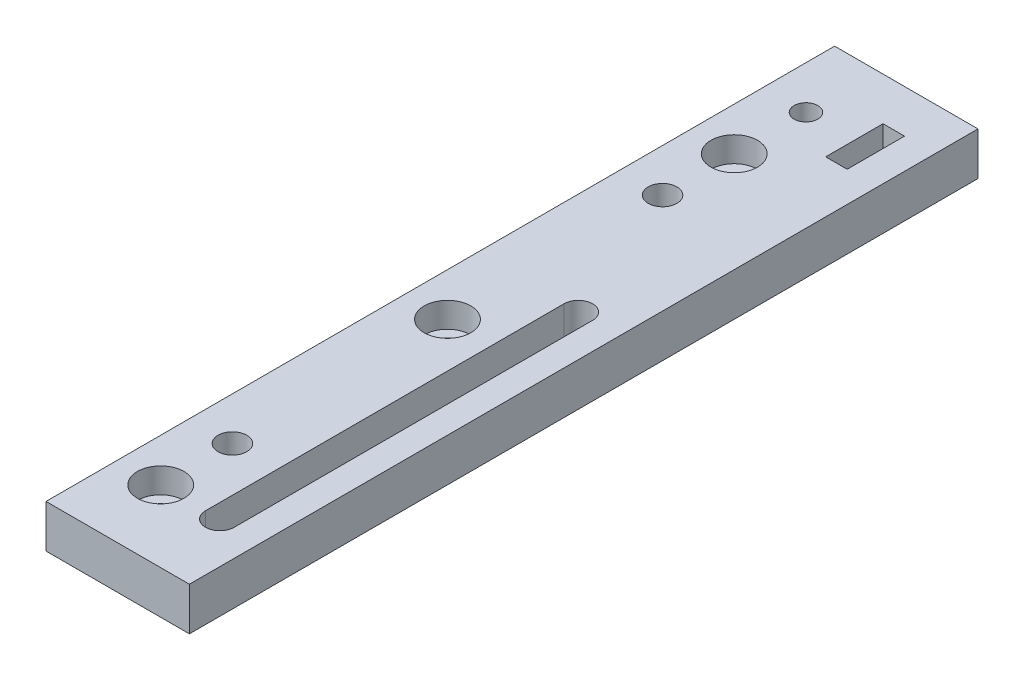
SolidWorks part; units mm, degrees
ref_plane "前视基准面" through (0, 0, 0) normal (0, 0, 1) x (1, 0, 0)
ref_plane "上视基准面" through (0, 0, 0) normal (0, 1, 0) x (1, 0, 0)
ref_plane "右视基准面" through (0, 0, 0) normal (1, 0, 0) x (0, 0, -1)
sketch "草图1" plane through (0, 0, 0) normal (0, 0, 1) x (1, 0, 0)
  line L0 (0, 0) -> (0, 6)
  line L1 (20, 0) -> (20, 6)
  line L2 (0, 0) -> (20, 0)
  line L3 (0, 6) -> (20, 6)
extrude "凸台-拉伸1" add sketch "草图1" along normal blind 110
sketch "草图2" plane through (0, 6, 0) normal (0, 1, 0) x (1, 0, 0)
  line L0 (0, -110) -> (0, 0)
  line L1 (20, -110) -> (20, 0)
  line L2 (0, -110) -> (20, -110)
  line L3 (0, 0) -> (20, 0)
  line L4 (12.25, -50) -> (12.25, -100)
  line L5 (16.25, -100) -> (16.25, -50)
  line L6 (12.75, -14) -> (12.75, -6)
  line L7 (15.75, -14) -> (15.75, -6)
  line L8 (12.75, -6) -> (15.75, -6)
  line L9 (12.75, -14) -> (15.75, -14)
  circle A0 centre (6, -20) radius 1.75
  circle A1 centre (6, -60) radius 1.75
  circle A2 centre (6, -100) radius 1.75
  circle A3 centre (6, -30) radius 2
  circle A4 centre (6, -90) radius 2
  arc A5 (12.25, -100) -> (16.25, -100) centre (14.25, -100) ccw
  arc A6 (16.25, -50) -> (12.25, -50) centre (14.25, -50) ccw
  circle A7 centre (6, -10) radius 1.65
extrude "切除-拉伸1" cut sketch "草图2" against normal blind 110 flip side to cut
sketch "草图3" plane through (0, 6, 0) normal (0, 1, 0) x (1, 0, 0)
  circle A0 centre (6, -20) radius 3.25
  circle A1 centre (6, -60) radius 3.25
  circle A2 centre (6, -100) radius 3.25
extrude "切除-拉伸2" cut sketch "草图3" against normal blind 3.5
